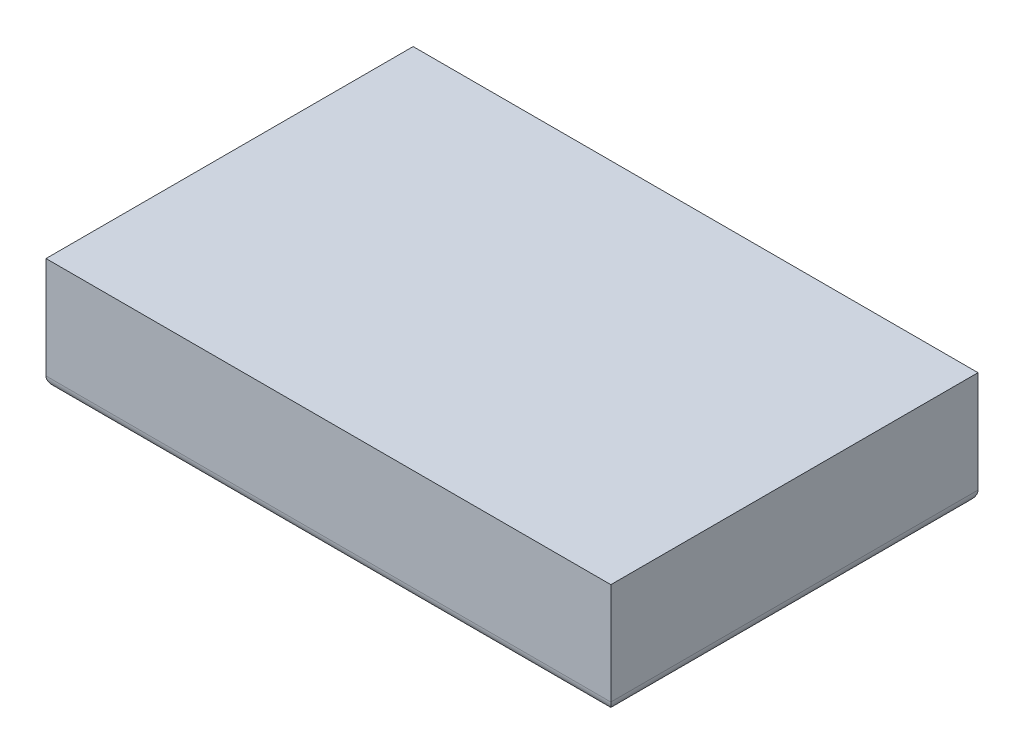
SolidWorks part; units mm, degrees
ref_plane "Front Plane" through (0, 0, 0) normal (0, 0, 1) x (1, 0, 0)
ref_plane "Top Plane" through (0, 0, 0) normal (0, 1, 0) x (1, 0, 0)
ref_plane "Right Plane" through (0, 0, 0) normal (1, 0, 0) x (0, 0, -1)
sketch "Sketch2" plane through (0, 0, 0) normal (0, 1, 0) x (1, 0, 0)
  line L1 (-5, 3.25) -> (5, 3.25)
  line L2 (-5, 3.25) -> (-5, -3.25)
  line L3 (-5, -3.25) -> (5, -3.25)
  line L4 (5, 3.25) -> (5, -3.25)
  line L5 (-5, 3.25) -> (5, -3.25) construction
  line L6 (-5, -3.25) -> (5, 3.25) construction
  point P1 (0, 0)
  dimension "D1" = 6.5
  dimension "D2" = 10
extrude "Boss-Extrude1" add sketch "Sketch2" along normal blind 2
fillet "3D print Fillet" radius 0.2 4 edges at (0, 0, -3.25) (-5, 0, 0) (0, 0, 3.25) (5, 0, 0)
